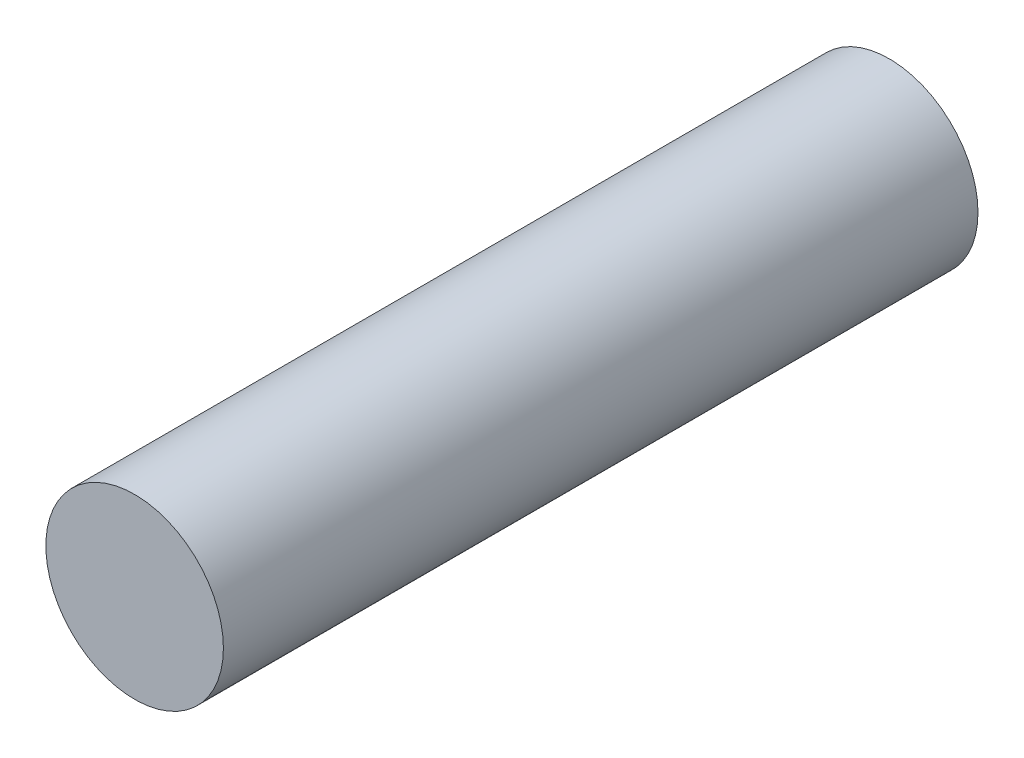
SolidWorks part; units mm, degrees
ref_plane "Front Plane" through (0, 0, 0) normal (0, 0, 1) x (1, 0, 0)
ref_plane "Top Plane" through (0, 0, 0) normal (0, 1, 0) x (1, 0, 0)
ref_plane "Right Plane" through (0, 0, 0) normal (1, 0, 0) x (0, 0, -1)
sketch "Sketch2" plane through (0, 0, 0) normal (0, 0, 1) x (1, 0, 0)
  circle A0 centre (0, 0) radius 10.16
  dimension "D1" = 20.32
extrude "Boss-Extrude1" add sketch "Sketch2" along normal blind 86.36
